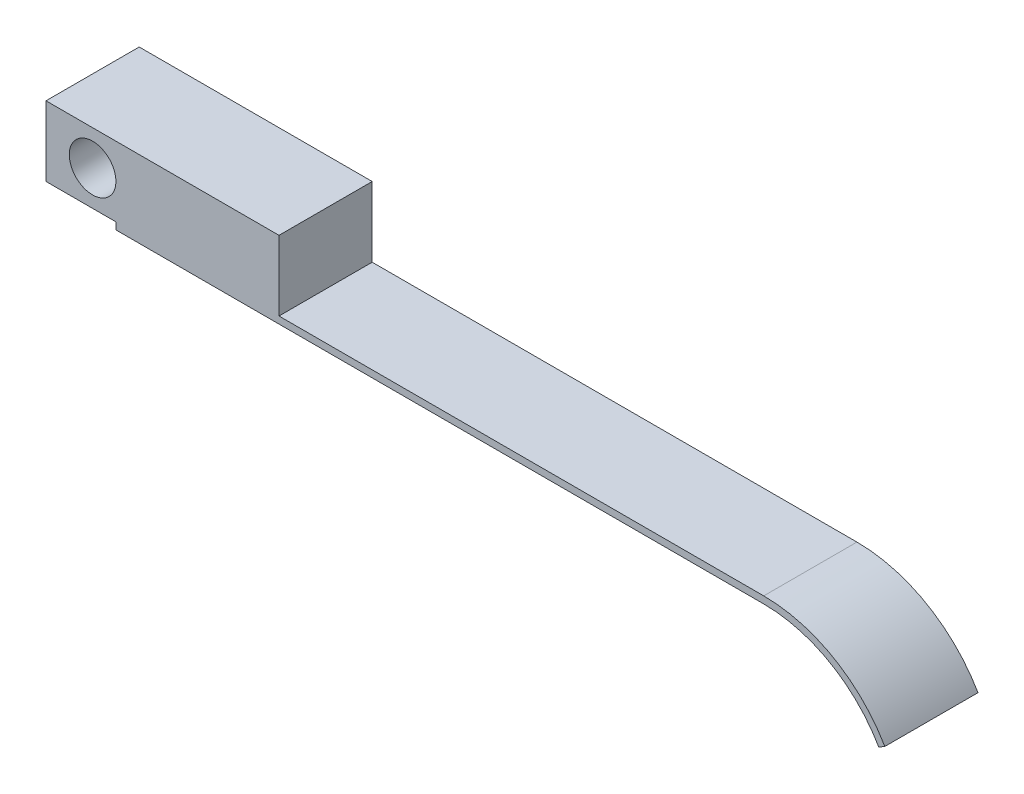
SolidWorks part; units mm, degrees
ref_plane "Face" through (0, 0, 0) normal (0, 0, 1) x (1, 0, 0)
ref_plane "Dessus" through (0, 0, 0) normal (0, 1, 0) x (1, 0, 0)
ref_plane "Droite" through (0, 0, 0) normal (1, 0, 0) x (0, 0, -1)
sketch "Esquisse1" plane through (0, 0, 0) normal (0, 0, 1) x (1, 0, 0)
  line L0 (0, 7.5) -> (73.8686, 7.5) construction
  line L1 (0, 0) -> (50, 0)
  line L2 (0, 0) -> (0, 15)
  line L3 (0, 15) -> (50, 15)
  line L4 (50, 0) -> (50, 15)
  circle A0 centre (10, 7.5) radius 5
  dimension "D3" = 10
  dimension "D4" = 10
  dimension "D1" = 15
  dimension "D2" = 50
extrude "Base-Extrusion" add sketch "Esquisse1" along normal blind 20
sketch "Esquisse2" plane through (0, 0, 20) normal (0, 0, 1) x (1, 0, 0)
  line L0 (15, 0) -> (154.0192, 0)
  line L1 (0, 0) -> (50, 0) construction
  line L2 (154.0192, 0) -> (154.0192, -30) construction
  line L3 (154.0192, -30) -> (196.4594, -5.4972) construction
  line L4 (15, -1.5) -> (154.0192, -1.5)
  line L5 (15, 0) -> (15, -1.5)
  line L6 (178.701, -15.75) -> (180, -15)
  arc A0 (180, -15) -> (154.0192, 0) centre (154.0192, -30) ccw
  arc A1 (178.701, -15.75) -> (154.0192, -1.5) centre (154.0192, -30) ccw
  dimension "D1" = 60
  dimension "D2" = 60
  dimension "D3" = 180
  dimension "D4" = 1.5
  dimension "D5" = 15
extrude "Boss.-Extru.1" add sketch "Esquisse2" against normal through all
